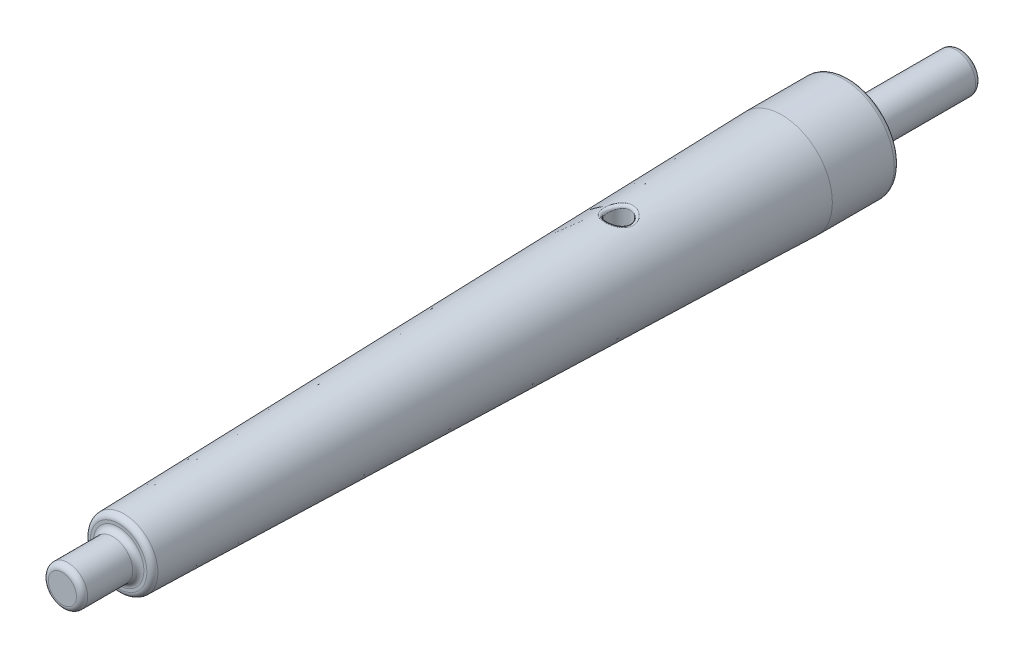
SolidWorks part; units mm, degrees
ref_plane "Спереди" through (0, 0, 0) normal (0, 0, 1) x (1, 0, 0)
ref_plane "Сверху" through (0, 0, 0) normal (0, 1, 0) x (1, 0, 0)
ref_plane "Справа" through (0, 0, 0) normal (1, 0, 0) x (0, 0, -1)
sketch "Эскиз1" plane through (0, 0, 0) normal (1, 0, 0) x (0, 0, -1)
  line L0 (-40, 0) -> (40, 0)
  line L1 (-40, 0) -> (-40, 1.75)
  line L2 (-40, 1.75) -> (-35, 1.75)
  line L3 (-35, 1.75) -> (-35, 3)
  line L4 (-35, 3) -> (24, 4.5)
  line L5 (24, 4.5) -> (30, 4.5)
  line L6 (30, 4.5) -> (30, 1.75)
  line L7 (30, 1.75) -> (40, 1.75)
  line L8 (40, 1.75) -> (40, 0)
  dimension "D1" = 65
  dimension "D2" = 59
  dimension "D3" = 5
  dimension "D4" = 3
  dimension "D5" = 1.75
  dimension "D6" = 4.5
  dimension "D7" = 10
revolve "Повернуть1" add sketch "Эскиз1" angle 360 about L0
sketch "Эскиз2" plane through (0, 0, 0) normal (0, 1, 0) x (1, 0, 0)
  line L0 (-1.75, -35) -> (1.75, -35) construction
  circle A0 centre (0, 9.5) radius 1
  dimension "D1" = 2
  dimension "D2" = 44.5
extrude "Вырез-Вытянуть1" cut sketch "Эскиз2" against normal mid plane 10
fillet "Скругление1" radius 0.5 6 edges at (1.75, 0, -40) (1.75, 0, -30) (1.75, 0, 35) (1.75, 0, 40) (4.5, 0, -30) (3, 0, 35)
fillet "Скругление2" radius 0.25 2 edges at (0.7057, -4.0524, -8.7914) (0.3826, 4.09, -8.5761)
